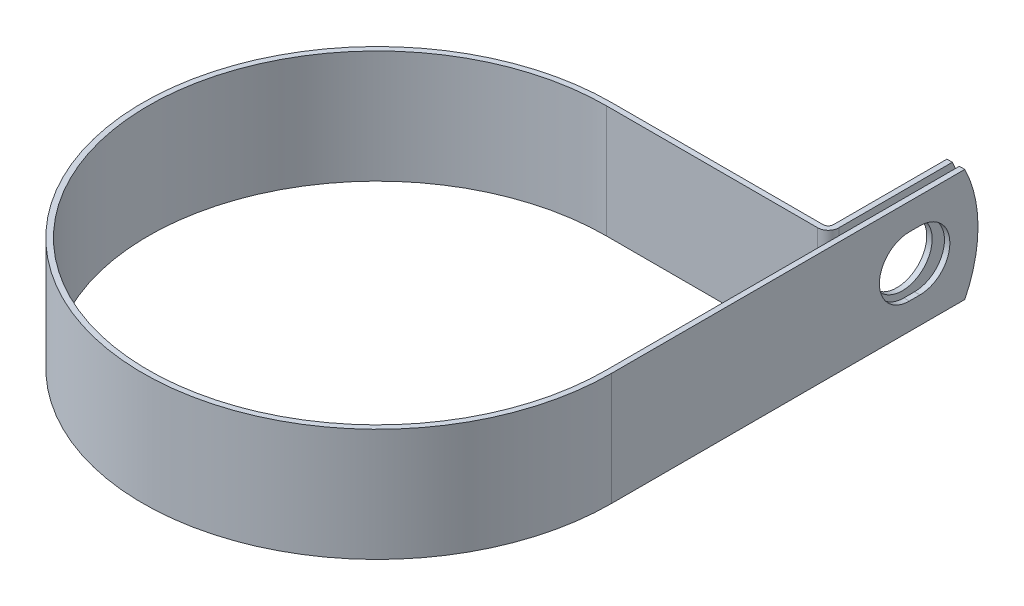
SolidWorks part; units mm, degrees
ref_plane "Front Plane" through (0, 0, 0) normal (0, 0, 1) x (1, 0, 0)
ref_plane "Top Plane" through (0, 0, 0) normal (0, 1, 0) x (1, 0, 0)
ref_plane "Right Plane" through (0, 0, 0) normal (1, 0, 0) x (0, 0, -1)
sketch "Sketch1" plane through (0, 0, 0) normal (0, 1, 0) x (1, 0, 0)
  line L0 (0, 51.5874) -> (47.6352, 51.5874)
  line L1 (51.5874, 0) -> (51.5874, 51.5874)
  line L2 (50.0126, 82.5246) -> (50.0126, 53.9648)
  line L5 (51.5874, 51.5874) -> (51.5874, 82.5246)
  arc A0 (0, 51.5874) -> (51.5874, 0) centre (0, 0) ccw
  arc A3 (47.6352, 51.5874) -> (50.0126, 53.9648) centre (47.6352, 53.9648) ccw
extrude "Extrude-Thin1" add sketch "Sketch1" along normal mid plane 25.4 thin
sketch "Sketch2" plane through (48.7934, 0, 0) normal (-1, 0, 0) x (0, 0, 1)
  line L0 (-82.5246, 12.7) -> (-82.5246, -12.7) construction
  line L7 (0, 12.7) -> (0, -12.7) construction
  circle A0 centre (-68.2498, 0) radius 6.7437
  point P2 (-82.5246, 0)
extrude "Cut-Extrude1" cut sketch "Sketch2" against normal up to surface (1.2192 mm away)
sketch "Sketch3" plane through (52.8066, 0, 0) normal (1, 0, 0) x (0, 0, -1)
  line L0 (67.056, 0) -> (69.4436, 0) construction
  line L1 (67.056, 6.7437) -> (69.4436, 6.7437)
  line L2 (67.056, -6.7437) -> (69.4436, -6.7437)
  line L3 (82.5246, 12.7) -> (82.5246, -12.7) construction
  arc A0 (67.056, 6.7437) -> (67.056, -6.7437) centre (67.056, 0) ccw
  arc A1 (69.4436, -6.7437) -> (69.4436, 6.7437) centre (69.4436, 0) ccw
  point P3 (68.2498, 0)
  point P8 (82.5246, 0)
  point P11 (60.3123, 0)
  point P12 (76.1873, 0)
extrude "Cut-Extrude2" cut sketch "Sketch3" against normal up to surface (1.2192 mm away)
sketch "Sketch4" plane through (48.7934, 0, 0) normal (-1, 0, 0) x (0, 0, 1)
  line L0 (-82.5246, 12.7) -> (-82.5246, -12.7)
  line L1 (-82.5246, 12.7) -> (-79.5473, 12.7)
  line L2 (-82.5246, 12.7) -> (-53.9648, 12.7) construction
  line L3 (-82.5246, -12.7) -> (-79.5473, -12.7)
  line L4 (-82.5246, -12.7) -> (-53.9648, -12.7) construction
  arc A0 (-79.5473, 12.7) -> (-79.5473, -12.7) centre (-53.9496, 0) ccw
extrude "Cut-Extrude3" cut sketch "Sketch4" against normal through all contours A0 M4 M5 | A0 L0 M2
equation "\"D1@Sketch3\" = \"D2@Sketch2\""
equation "\"D7@Sketch1\" = \"D3@Sketch2\" + \"D1@Sketch3\""
equation "\"D1@Sketch4\" = ( \"D1@Extrude-Thin1\" + .125 ) * 2"
equation "\"D2@Sketch1\"=1.95*\"D5@Extrude-Thin1\""
equation "\"D2@Sketch3\" = \"D1@Sketch2\""
